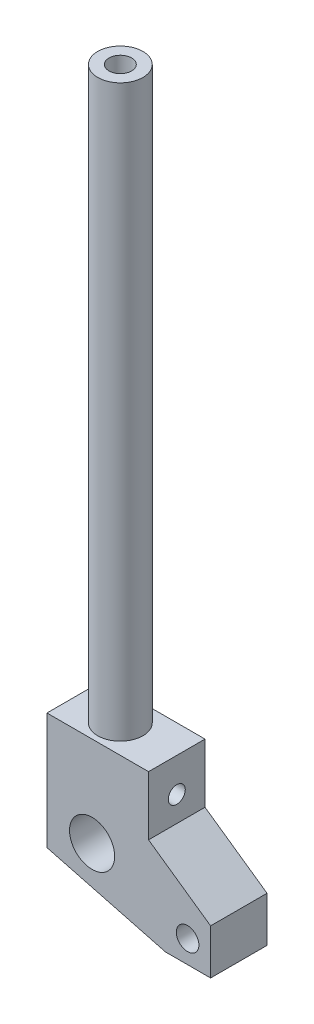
SolidWorks part; units mm, degrees
ref_plane "Front Plane" through (0, 0, 0) normal (0, 0, 1) x (1, 0, 0)
ref_plane "Top Plane" through (0, 0, 0) normal (0, 1, 0) x (1, 0, 0)
ref_plane "Right Plane" through (0, 0, 0) normal (1, 0, 0) x (0, 0, -1)
sketch "Sketch1" plane through (0, 0, 0) normal (0, 0, 1) x (1, 0, 0)
  line L0 (0, 0) -> (26.8517, -9.7732)
  line L1 (0, 0) -> (0, 25.4) construction
  line L2 (0, 0) -> (33.3248, 0) construction
  line L3 (-12.7, -16.129) -> (33.3248, -16.129)
  line L4 (33.3248, -16.129) -> (33.3248, 25.4)
  line L5 (33.3248, 25.4) -> (-12.7, 25.4)
  line L6 (-12.7, 25.4) -> (-12.7, -16.129)
  line L7 (15.875, 25.4) -> (15.875, 8.7895)
  line L8 (15.875, 8.7895) -> (33.3248, -3.429)
  line L9 (0, 15.875) -> (-12.7, 15.875)
  line L10 (-12.7, -7.3914) -> (20.6248, -16.129)
  circle A0 centre (0, 0) radius 6.35
  circle A1 centre (26.8517, -9.7732) radius 3.175
  dimension "D1" = 12.7
  dimension "D3" = 6.35
  dimension "D2" = 28.575
  dimension "D4" = 20
  dimension "D5" = 16.129
  dimension "D6" = 12.7
  dimension "D7" = 33.3248
  dimension "D8" = 25.4
  dimension "D9" = 15.875
  dimension "D10" = 12.7
  dimension "D11" = 125
  dimension "D12" = 15.875
  dimension "D13" = 12.7
  dimension "D14" = 8.7376
  dimension "D15" = 6.4731
  dimension "D16" = 6.3558
sketch "Sketch2" plane through (0, 0, 0) normal (0, 0, 1) x (1, 0, 0)
  line L0 (-12.7, -16.129) -> (33.3248, -16.129) construction
  line L1 (33.3248, -16.129) -> (33.3248, 25.4) construction
  line L2 (33.3248, 25.4) -> (-12.7, 25.4) construction
  line L3 (-12.7, 25.4) -> (-12.7, -16.129) construction
  line L4 (20.6248, -16.129) -> (33.3248, -16.129)
  line L5 (33.3248, -16.129) -> (33.3248, -3.429)
  line L6 (15.875, 25.4) -> (-12.7, 25.4)
  line L7 (-12.7, 25.4) -> (-12.7, -7.3914)
  line L8 (15.875, 8.7895) -> (33.3248, -3.429) construction
  line L9 (15.875, 25.4) -> (15.875, 8.7895) construction
  line L10 (15.875, 8.7895) -> (33.3248, -3.429)
  line L11 (15.875, 25.4) -> (15.875, 8.7895)
  line L12 (-12.7, -7.3914) -> (20.6248, -16.129) construction
  line L13 (-12.7, -7.3914) -> (20.6248, -16.129)
  circle A0 centre (26.8517, -9.7732) radius 3.175 construction
  circle A1 centre (0, 0) radius 6.35 construction
  circle A2 centre (26.8517, -9.7732) radius 3.175
  circle A3 centre (0, 0) radius 6.35
extrude "Boss-Extrude1" add sketch "Sketch2" along normal mid plane 15.875
sketch "Sketch3" plane through (0, 0, 0) normal (0, 1, 0) x (1, 0, 0)
  circle A0 centre (0, 0) radius 6.35
  dimension "D1" = 12.7
extrude "Cut-Extrude1" cut sketch "Sketch3" along normal blind 25.4 from offset 7.9248
sketch "Sketch4" plane through (0, 0, 0) normal (1, 0, 0) x (0, 0, -1)
  circle A0 centre (0, 15.875) radius 2.3876
  circle A1 centre (0, 15.875) radius 3.9624
  dimension "D1" = 4.7752
  dimension "D2" = 7.9248
sketch "Sketch5" plane through (0, 0, 0) normal (1, 0, 0) x (0, 0, -1)
  circle A0 centre (0, 15.875) radius 2.3876 construction
  circle A1 centre (0, 15.875) radius 2.3876
extrude "Cut-Extrude2" cut sketch "Sketch5" along normal blind 25.4
sketch "Sketch6" plane through (0, 0, 0) normal (1, 0, 0) x (0, 0, -1)
  circle A0 centre (0, 15.875) radius 3.9624 construction
  circle A1 centre (0, 15.875) radius 3.9624
extrude "Cut-Extrude3" cut sketch "Sketch6" against normal blind 25.4
sketch "Sketch7" plane through (0, 0, 0) normal (0, 1, 0) x (1, 0, 0)
  circle A0 centre (0, 0) radius 6.35
  dimension "D1" = 12.7
extrude "Extrude-Thin1" add sketch "Sketch7" along normal blind 177.8 from offset 7.9248 separate body thin
sketch "Sketch9" plane through (0, 0, 0) normal (1, 0, 0) x (0, 0, -1)
  circle A0 centre (0, 15.875) radius 2.3876 construction
  circle A1 centre (0, 15.875) radius 2.3876
extrude "Cut-Extrude4" cut sketch "Sketch9" against normal mid plane 12.7
